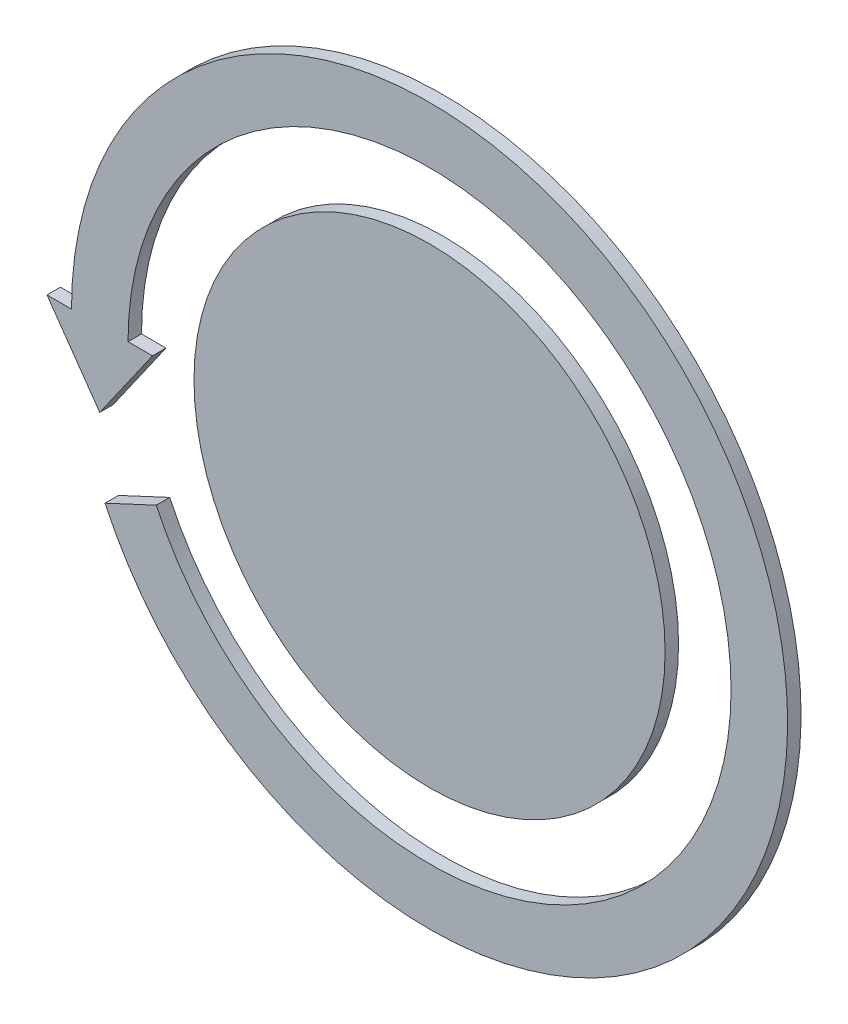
SolidWorks part; units mm, degrees
ref_plane "Ebene vorne" through (0, 0, 0) normal (0, 0, 1) x (1, 0, 0)
ref_plane "Ebene oben" through (0, 0, 0) normal (0, 1, 0) x (1, 0, 0)
ref_plane "Ebene rechts" through (0, 0, 0) normal (1, 0, 0) x (0, 0, -1)
sketch "Skizze1" plane through (0, 0, 0) normal (0, 0, 1) x (1, 0, 0)
  line L0 (-40.5987, -18.9315) -> (-48.2109, -22.4811)
  line L1 (-56.8344, 0) -> (-48.9954, -11.1956)
  line L2 (-48.9954, -11.1956) -> (-41.156, 0)
  line L3 (-41.156, 0) -> (-44.7957, 0)
  line L4 (-53.1948, 0) -> (-56.8344, 0)
  line L5 (0, 0) -> (-31.7177, -14.7902) construction
  line L6 (-31.7177, -14.7902) -> (-40.5987, -18.9315) construction
  circle A0 centre (0, 0) radius 34.9966
  arc A1 (-40.5987, -18.9315) -> (-44.7957, 0) centre (0, 0) ccw
  arc A2 (-48.2109, -22.4811) -> (-53.1948, 0) centre (0, 0) ccw
  arc A3 (-44.535, -4.8256) -> (-40.5987, -18.9315) centre (0, 0) ccw construction
  arc A4 (-52.8967, -5.6238) -> (-48.2109, -22.4811) centre (0, 0) ccw construction
  arc A5 (-53.1948, 0) -> (-52.8967, -5.6238) centre (0, 0) ccw construction
  arc A6 (-44.7957, 0) -> (-44.535, -4.8256) centre (0, 0) ccw construction
  point P17 (0, 0)
  dimension "D4" = 106.3896
  dimension "D5" = 55.001
  dimension "D6" = 55
  dimension "D1" = 69.9932
  dimension "D2" = 89.5913
  dimension "D3" = 25
  dimension "D7" = 41.156
  dimension "D8" = 3.6397
  dimension "D9" = 3.6396
extrude "Aufsatz-Linear austragen1" add sketch "Skizze1" along normal blind 2
